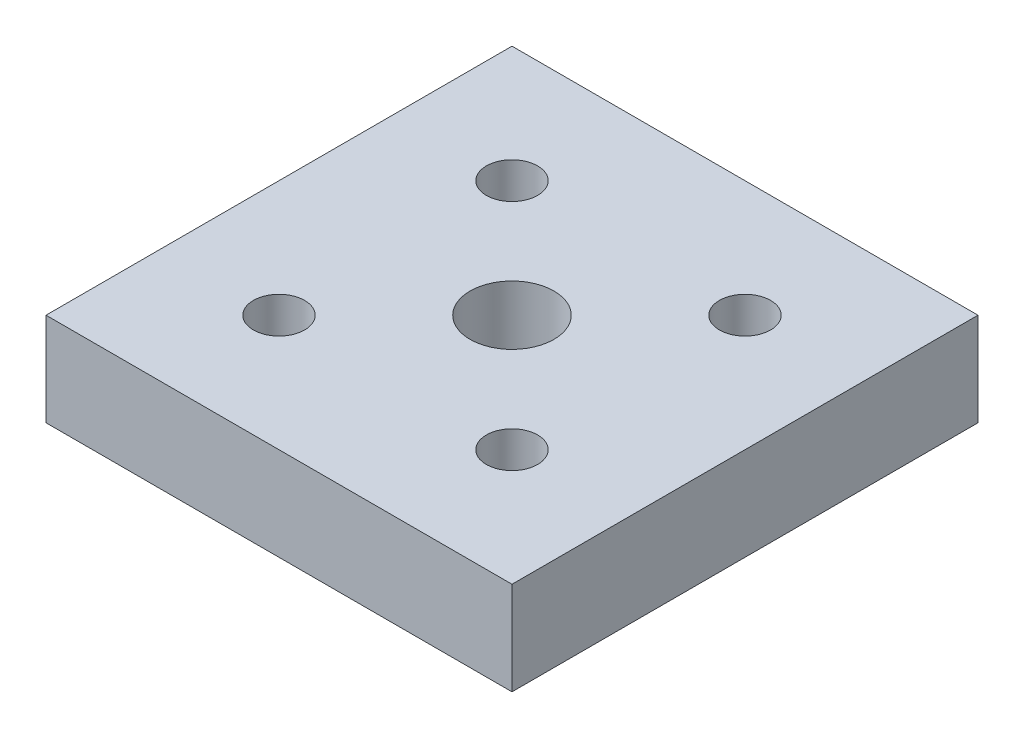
SolidWorks part; units mm, degrees
ref_plane "正面" through (0, 0, 0) normal (0, 0, 1) x (1, 0, 0)
ref_plane "平面" through (0, 0, 0) normal (0, 1, 0) x (1, 0, 0)
ref_plane "右側面" through (0, 0, 0) normal (1, 0, 0) x (0, 0, -1)
sketch "ｽｹｯﾁ1" plane through (0, 0, 0) normal (0, 1, 0) x (1, 0, 0)
  line L1 (0, 0) -> (60, 0)
  line L2 (0, 0) -> (0, 60)
  line L3 (0, 60) -> (60, 60)
  line L4 (60, 0) -> (60, 60)
  dimension "D1" = 60
  dimension "D2" = 60
extrude "押し出し1" add sketch "ｽｹｯﾁ1" along normal blind 12
hole_wizard "M12x1.25 ねじ穴1" positions "3Dｽｹｯﾁ2" profile "ｽｹｯﾁ8" tap size "M12x1.25" standard "JIS"
sketch3d "3Dｽｹｯﾁ2"
  line L0 (0, 0, -60) -> (0, 0, 0) construction
  line L1 (60, 0, -60) -> (0, 0, -60) construction
  point P0 (30, 0, -30)
  dimension "D1" = 30
  dimension "D2" = 30
sketch "ｽｹｯﾁ8" plane through (30, 0, -30) normal (1, 0, 0) x (0, 0, -1)
  line L0 (0, 0) -> (0, 12)
  line L1 (0, 12) -> (5.4, 12)
  line L2 (5.4, 12) -> (5.4, 0)
  line L5 (5.4, 0) -> (0, 0)
  line L11 (0, -6.35) -> (0, 107.95) construction
  dimension "次ｻｰﾌｪｽまでのねじ下穴ﾄﾞﾘﾙ直径" = 10.8
  dimension "次ｻｰﾌｪｽまでのねじ下穴ﾄﾞﾘﾙの深さ" = 12
hole_wizard "穴1" positions "3Dｽｹｯﾁ4" profile "ｽｹｯﾁ9" legacy
sketch3d "3Dｽｹｯﾁ4"
  line L0 (0, 0, -60) -> (0, 0, 0) construction
  line L1 (60, 0, -60) -> (0, 0, -60) construction
  point P0 (15, 0, -15)
  point P2 (45, 0, -15)
  point P4 (45, 0, -45)
  point P6 (15, 0, -45)
  dimension "D1" = 15
  dimension "D2" = 30
  dimension "D3" = 15
  dimension "D4" = 30
sketch "ｽｹｯﾁ9" plane through (15, 0, -15) normal (1, 0, 0) x (0, 0, -1)
  line L0 (0, 0) -> (0, 12)
  line L1 (0, 12) -> (3.3, 12)
  line L2 (3.3, 12) -> (3.3, 6.5)
  line L3 (3.3, 6.5) -> (5.5, 6.5)
  line L4 (5.5, 6.5) -> (5.5, 0)
  line L5 (5.5, 0) -> (0, 0)
  line L6 (0, 110) -> (0, -10) construction
  dimension "直径" = 6.6
  dimension "深さ" = 12
  dimension "座ぐり穴-直径" = 11
  dimension "座ぐり穴-深さ" = 6.5
